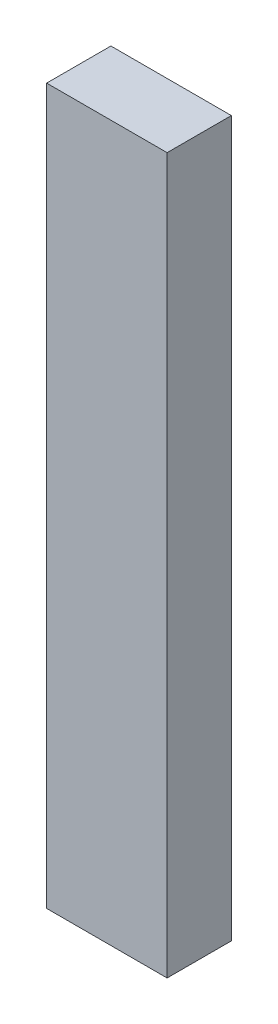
SolidWorks part; units mm, degrees
ref_plane "Plan de face" through (0, 0, 0) normal (0, 0, 1) x (1, 0, 0)
ref_plane "Plan de dessus" through (0, 0, 0) normal (0, 1, 0) x (1, 0, 0)
ref_plane "Plan de droite" through (0, 0, 0) normal (1, 0, 0) x (0, 0, -1)
sketch "Esquisse1" plane through (0, 0, 0) normal (0, 0, 1) x (1, 0, 0)
  line L1 (0, 0) -> (15, 0)
  line L2 (0, 0) -> (0, 89)
  line L3 (0, 89) -> (15, 89)
  line L4 (15, 0) -> (15, 89)
  dimension "D1" = 15
  dimension "D2" = 89
extrude "Extrusion1" add sketch "Esquisse1" along normal blind 8
